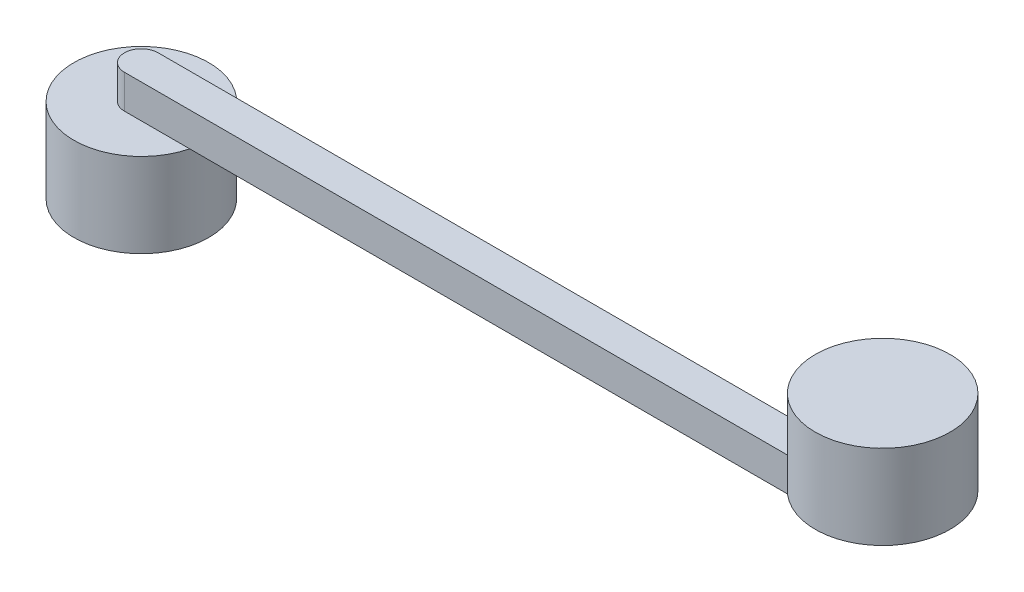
SolidWorks part; units mm, degrees
ref_plane "Front Plane" through (0, 0, 0) normal (0, 0, 1) x (1, 0, 0)
ref_plane "Top Plane" through (0, 0, 0) normal (0, 1, 0) x (1, 0, 0)
ref_plane "Right Plane" through (0, 0, 0) normal (1, 0, 0) x (0, 0, -1)
sketch "Sketch1" plane through (0, 0, 0) normal (0, 1, 0) x (1, 0, 0)
  line L0 (-139.7, 6.35) -> (139.7, 6.35)
  line L1 (139.7, -6.35) -> (-139.7, -6.35)
  line L2 (-139.7, 0) -> (139.7, 0) construction
  arc A0 (139.7, 6.35) -> (139.7, -6.35) centre (139.7, 0) cw
  arc A1 (-139.7, -6.35) -> (-139.7, 6.35) centre (-139.7, 0) cw
  dimension "D1" = 279.4
  dimension "D2" = 6.35
extrude "Extrude1" add sketch "Sketch1" along normal blind 12.7
sketch "Sketch2" plane through (0, 12.7, 0) normal (0, 1, 0) x (1, 0, 0)
  circle A0 centre (139.7, 0) radius 25.4
  dimension "D1" = 50.8
extrude "Extrude2" add sketch "Sketch2" along normal blind 31.75
sketch "Sketch3" plane through (0, 0, 0) normal (0, -1, 0) x (1, 0, 0)
  circle A0 centre (-139.7, 0) radius 25.4
  dimension "D1" = 50.8
extrude "Extrude3" add sketch "Sketch3" along normal blind 31.75
